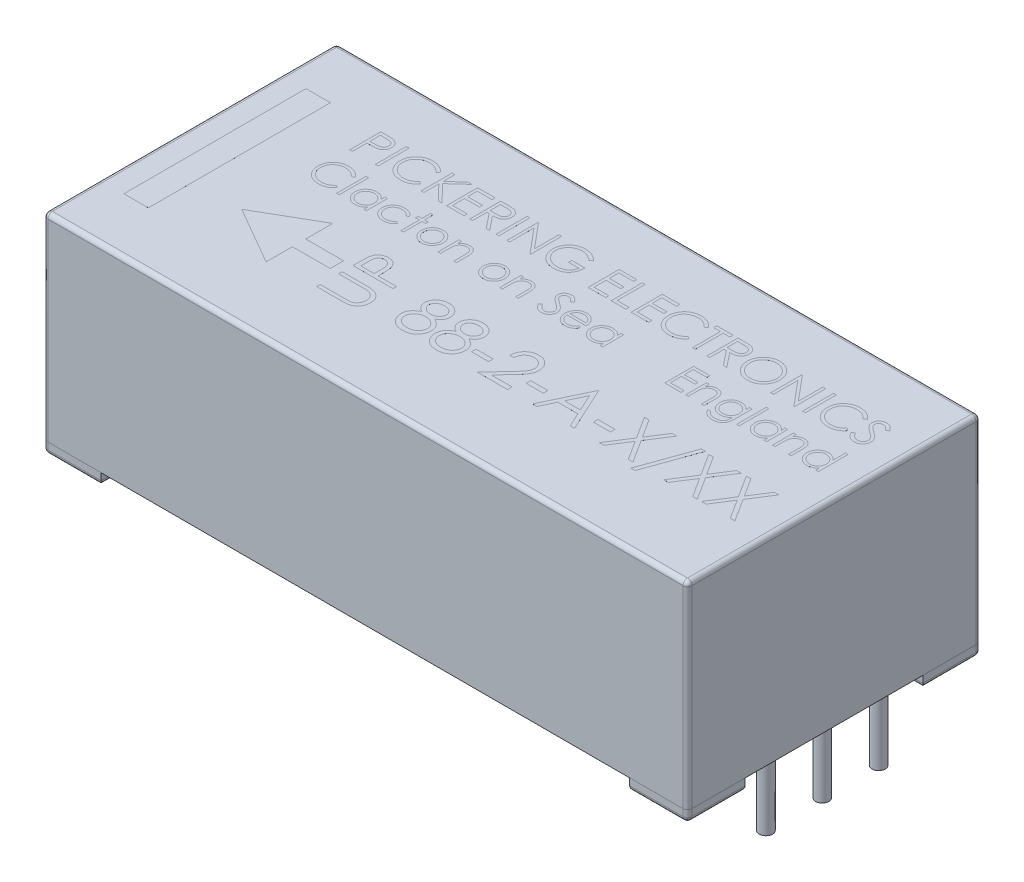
SolidWorks part; units mm, degrees
ref_plane "Front Plane" through (0, 0, 0) normal (0, 0, 1) x (1, 0, 0)
ref_plane "Top Plane" through (0, 0, 0) normal (0, 1, 0) x (1, 0, 0)
ref_plane "Right Plane" through (0, 0, 0) normal (1, 0, 0) x (0, 0, -1)
sketch "Sketch2" plane through (0, 0, 0) normal (0, 1, 0) x (1, 0, 0)
  line L1 (14.5, -6.6) -> (-14.5, -6.6)
  line L2 (14.5, -6.6) -> (14.5, 6.6)
  line L3 (14.5, 6.6) -> (-14.5, 6.6)
  line L4 (-14.5, -6.6) -> (-14.5, 6.6)
  line L5 (14.5, -6.6) -> (-14.5, 6.6) construction
  line L6 (14.5, 6.6) -> (-14.5, -6.6) construction
  point P0 (0, 0)
  dimension "D1" = 13.2
  dimension "D2" = 29
extrude "Main Body" add sketch "Sketch2" along normal blind 8.89 draft 0.023
sketch "Sketch9" plane through (0, 0, 0) normal (0, -1, 0) x (1, 0, 0)
  line L0 (14.5, -6.6) -> (-14.5, -6.6) construction
  line L1 (14.5, 6.6) -> (14.5, -6.6) construction
  circle A0 centre (12.7, -3.81) radius 0.3
  circle A1 centre (12.7, -1.27) radius 0.2963
  circle A2 centre (12.7, 1.27) radius 0.3
  dimension "D1" = 0.6
  dimension "D5" = 0.6
  dimension "D2" = 2.79
  dimension "D3" = 2.54
  dimension "D4" = 1.8
  dimension "D6" = 2.54
extrude "Pins" add sketch "Sketch9" along normal blind 4.31
mirror "Mirror2" about plane through (0, 0, 0) normal (1, 0, 0) of "Pins"
sketch "Sketch10" plane through (0, 0, 0) normal (0, -1, 0) x (1, 0, 0)
  line L1 (14.5, 6.6) -> (11.9, 6.6)
  line L2 (14.5, 6.6) -> (14.5, 4)
  line L3 (14.5, 4) -> (11.9, 4)
  line L4 (11.9, 6.6) -> (11.9, 4)
  dimension "D1" = 2.6
  dimension "D2" = 2.6
extrude "Foot" add sketch "Sketch10" along normal blind 0.51
sketch "Sketch11" plane through (0, -0.51, 0) normal (0, -1, 0) x (1, 0, 0)
  line L0 (14.5, 6.6) -> (11.9, 6.6) construction
  line L1 (11.9, 4) -> (13.95, 4)
  line L2 (11.9, 4) -> (11.9, 6.05)
  line L3 (11.9, 6.05) -> (13.95, 6.05)
  line L4 (13.95, 4) -> (13.95, 6.05)
  line L5 (14.5, 4) -> (14.5, 6.6) construction
  dimension "D1" = 0.55
  dimension "D2" = 0.55
extrude "Extrude2" cut sketch "Sketch11" against normal up to surface (0.51 mm away)
mirror "Mirror3" about plane through (0, 0, 0) normal (0, 0, 1) of "Extrude2", "Foot"
mirror "Mirror4" about plane through (0, 0, 0) normal (1, 0, 0) of "Mirror3", "Foot", "Extrude2"
sketch "Sketch12"
  dimension "D1" = 1.1
  dimension "D2" = 8.2
  dimension "D3" = 2.4965
  dimension "D4" = 1.4
  dimension "D5" = 2
  dimension "D6" = 3.8
extrude "Lettering" add sketch "Sketch12" along normal blind 0.0001
fillet "Fillet2" radius 0.2 36 edges at (14.5, -0.255, -6.6) (-14.5, -0.255, -6.6) (14.5, -0.255, 6.6) (-14.5, -0.255, 6.6) (14.4983, 4.445, -6.5983) (-14.4983, 4.445, -6.5983) (0, 8.89, -6.5965) (-14.4965, 8.89, 0) (14.4983, 4.445, 6.5983) (-14.4983, 4.445, 6.5983) (0, 8.89, 6.5965) (14.225, -0.51, 4) (11.9, -0.51, 6.325) (12.925, -0.51, 6.05) (13.95, -0.51, 5.025) (14.225, -0.51, -4) (11.9, -0.51, -6.325) (13.95, -0.51, -5.025) (12.925, -0.51, -6.05) (-11.9, -0.51, -6.325) (-11.9, -0.51, 6.325) (-12.925, -0.51, 6.05) (-13.95, -0.51, 5.025) (-14.225, -0.51, 4) (-14.225, -0.51, -4) (-13.95, -0.51, -5.025) (-12.925, -0.51, -6.05) (-13.2, -0.51, -6.6) (-14.5, -0.51, -5.3) (-13.2, -0.51, 6.6) (-14.5, -0.51, 5.3) (13.2, -0.51, 6.6) (14.5, -0.51, 5.3) (13.2, -0.51, -6.6) (14.5, -0.51, -5.3) (14.4965, 8.89, 0)
sketch "Sketch13"
sketch_block_instance "UP-1"
sketch_block "UP"
sketch_block_instance "Block1-1"
sketch_block "Block1" parameters "D1"=1.7, "D2"=2.2, "D3"=2.6, "D4"=1.24
extrude "Extrude3" add sketch "Sketch13" along normal blind 0.0001
